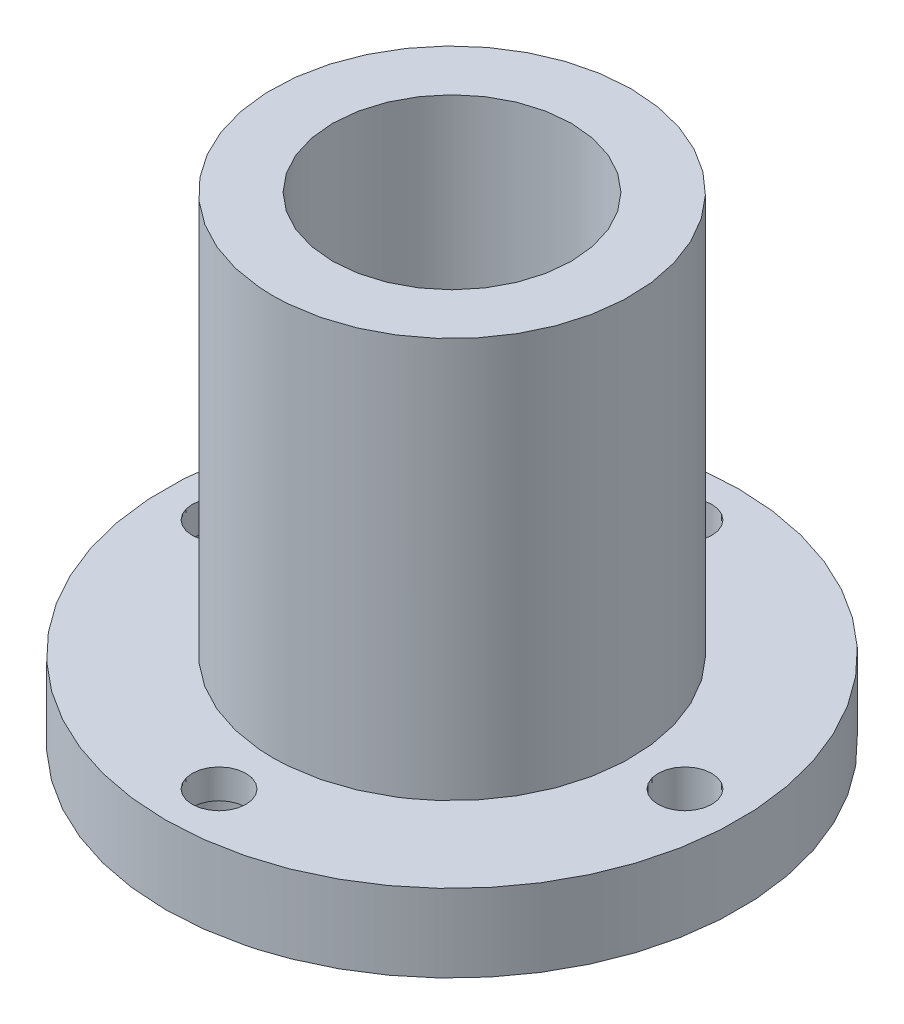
SolidWorks part; units mm, degrees
other "Solid2"
ref_plane "Front Plane" through (0, 0, 0) normal (0, 0, 1) x (1, 0, 0)
ref_plane "Top Plane" through (0, 0, 0) normal (0, 1, 0) x (1, 0, 0)
ref_plane "Right Plane" through (0, 0, 0) normal (1, 0, 0) x (0, 0, -1)
imported_body "2.7040 LMF40UU.stp<1>"
move or copy body "Body-Move/Copy1" bodies to move or copy 101 copy no rotation origin (40, 0, 0) rotation axis (0, 0, 1) rotation angle 90
